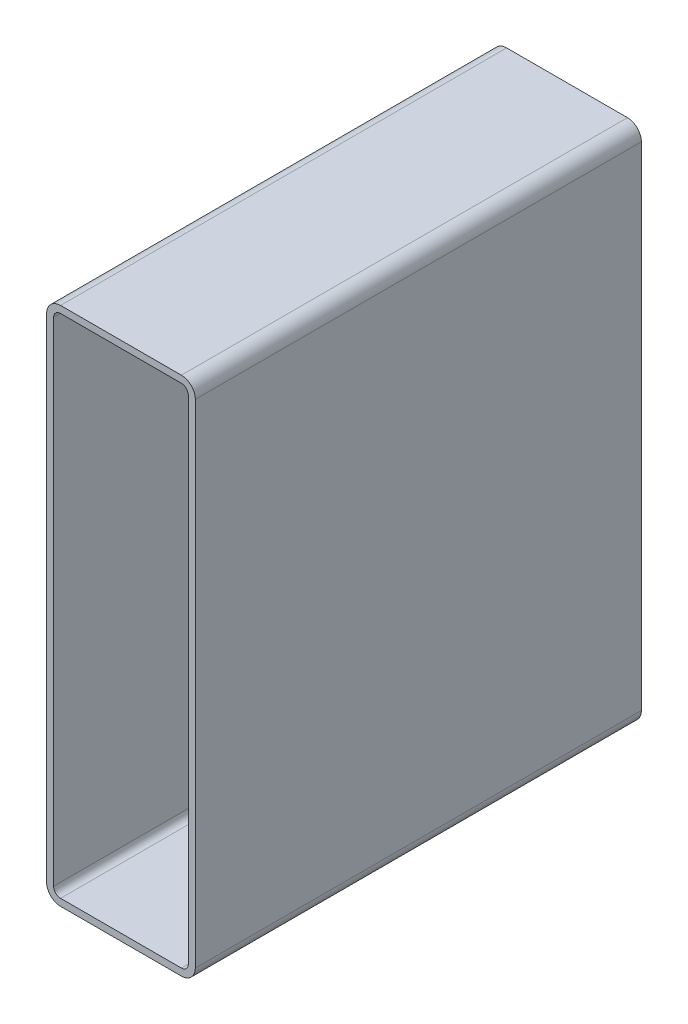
SolidWorks part; units mm, degrees
ref_plane "Front Plane" through (0, 0, 0) normal (0, 0, 1) x (1, 0, 0)
ref_plane "Top Plane" through (0, 0, 0) normal (0, 1, 0) x (1, 0, 0)
ref_plane "Right Plane" through (0, 0, 0) normal (1, 0, 0) x (0, 0, -1)
sketch "Sketch1" plane through (0, 0, 0) normal (0, 0, 1) x (1, 0, 0)
sketch_block_instance "HSS16x4x0.1875-1"
sketch_block "HSS16x4x0.1875"
extrude "Boss-Extrude1" add sketch "Sketch1" along normal blind 304.8
